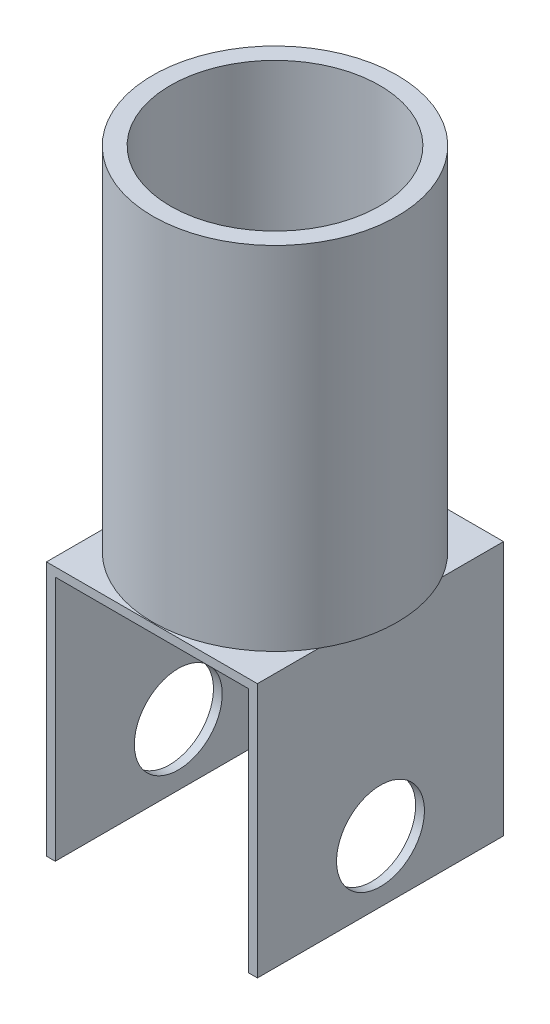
SolidWorks part; units mm, degrees
ref_plane "Front Plane" through (0, 0, 0) normal (0, 0, 1) x (1, 0, 0)
ref_plane "Top Plane" through (0, 0, 0) normal (0, 1, 0) x (1, 0, 0)
ref_plane "Right Plane" through (0, 0, 0) normal (1, 0, 0) x (0, 0, -1)
sketch "Sketch1" plane through (0, 0, 0) normal (0, 1, 0) x (1, 0, 0)
  circle A0 centre (0, 0) radius 69.5
  circle A1 centre (0, 0) radius 59.5
  dimension "D1" = 139
  dimension "D2" = 10
extrude "Boss-Extrude1" add sketch "Sketch1" along normal blind 200
sketch "Sketch2" plane through (0, 0, 0) normal (0, -1, 0) x (1, 0, 0)
  line L1 (-60, -70) -> (60, -70)
  line L2 (-60, -70) -> (-60, 70)
  line L3 (-60, 70) -> (60, 70)
  line L4 (60, -70) -> (60, 70)
  line L5 (-60, -70) -> (60, 70) construction
  line L6 (-60, 70) -> (60, -70) construction
  point P0 (0, 0)
  dimension "D1" = 120
  dimension "D2" = 140
extrude "Boss-Extrude2" add sketch "Sketch2" along normal blind 5
sketch "Sketch3" plane through (0, -5, 0) normal (0, -1, 0) x (1, 0, 0)
  line L0 (-60, -70) -> (60, -70) construction
  line L1 (-60, 70) -> (-55, 70)
  line L2 (-60, 70) -> (-60, -70)
  line L3 (-60, -70) -> (-55, -70)
  line L4 (-55, 70) -> (-55, -70)
  line L6 (60, 70) -> (55, 70)
  line L7 (60, 70) -> (60, -70)
  line L8 (60, -70) -> (55, -70)
  line L9 (55, 70) -> (55, -70)
  dimension "D1" = 5
  dimension "D2" = 5
extrude "Boss-Extrude3" add sketch "Sketch3" along normal blind 140
sketch "Sketch4" plane through (-60, 0, 0) normal (-1, 0, 0) x (0, 0, 1)
  line L0 (0, 0) -> (0, -135) construction
  line L1 (-35.0749, 0) -> (35.0749, 0) construction
  line L2 (70, -145) -> (-70, -145) construction
  circle A0 centre (0, -110) radius 25
  dimension "D1" = 50
  dimension "D2" = 35
extrude "Cut-Extrude1" cut sketch "Sketch4" against normal through all both and the other way through all
